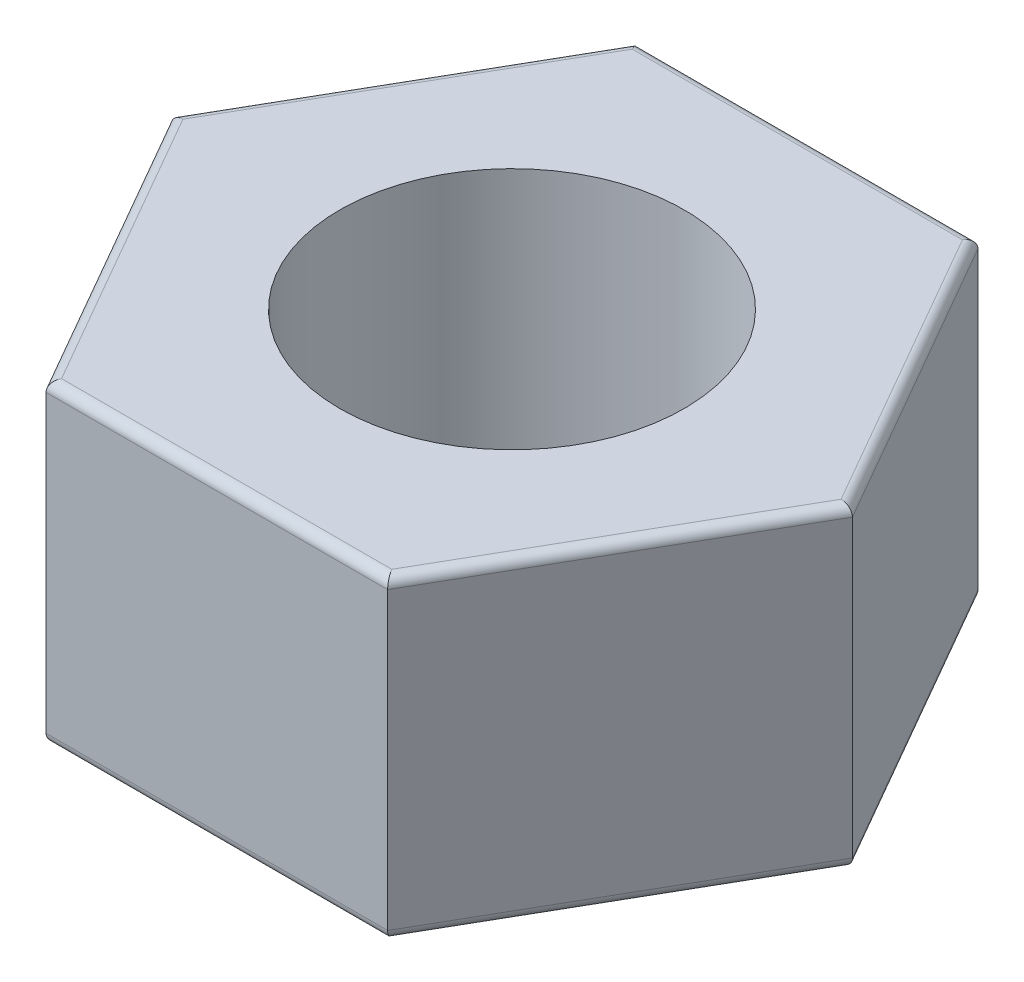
SolidWorks part; units mm, degrees
ref_plane "Plan de face" through (0, 0, 0) normal (0, 0, 1) x (1, 0, 0)
ref_plane "Plan de dessus" through (0, 0, 0) normal (0, 1, 0) x (1, 0, 0)
ref_plane "Plan de droite" through (0, 0, 0) normal (1, 0, 0) x (0, 0, -1)
sketch "Esquisse1" plane through (0, 0, 0) normal (0, 1, 0) x (1, 0, 0)
  line L0 (-17.3, 0) -> (17.3, 0) construction
  line L1 (0, -15) -> (0, 15) construction
  line L2 (-8.6808, 15) -> (8.6808, 15)
  line L3 (8.6808, 15) -> (17.3, 0)
  line L4 (-8.6808, 15) -> (-17.3, 0)
  line L5 (-8.6808, -15) -> (-17.3, 0)
  line L6 (8.6808, -15) -> (17.3, 0)
  line L7 (-8.6808, -15) -> (8.6808, -15)
  circle A0 centre (0, 0) radius 8.75
  point P8 (0, 0)
  dimension "D4" = 17.5
  dimension "D1" = 30
  dimension "D2" = 30
  dimension "D3" = 34.6
extrude "Extrusion1" add sketch "Esquisse1" along normal blind 16
fillet "Congé1" radius 0.5 12 edges at (0, 16, 15) (-12.9904, 0, 7.5) (-12.9904, 0, -7.5) (0, 0, -15) (12.9904, 0, -7.5) (12.9904, 0, 7.5) (0, 0, 15) (-12.9904, 16, 7.5) (-12.9904, 16, -7.5) (0, 16, -15) (12.9904, 16, -7.5) (12.9904, 16, 7.5)
